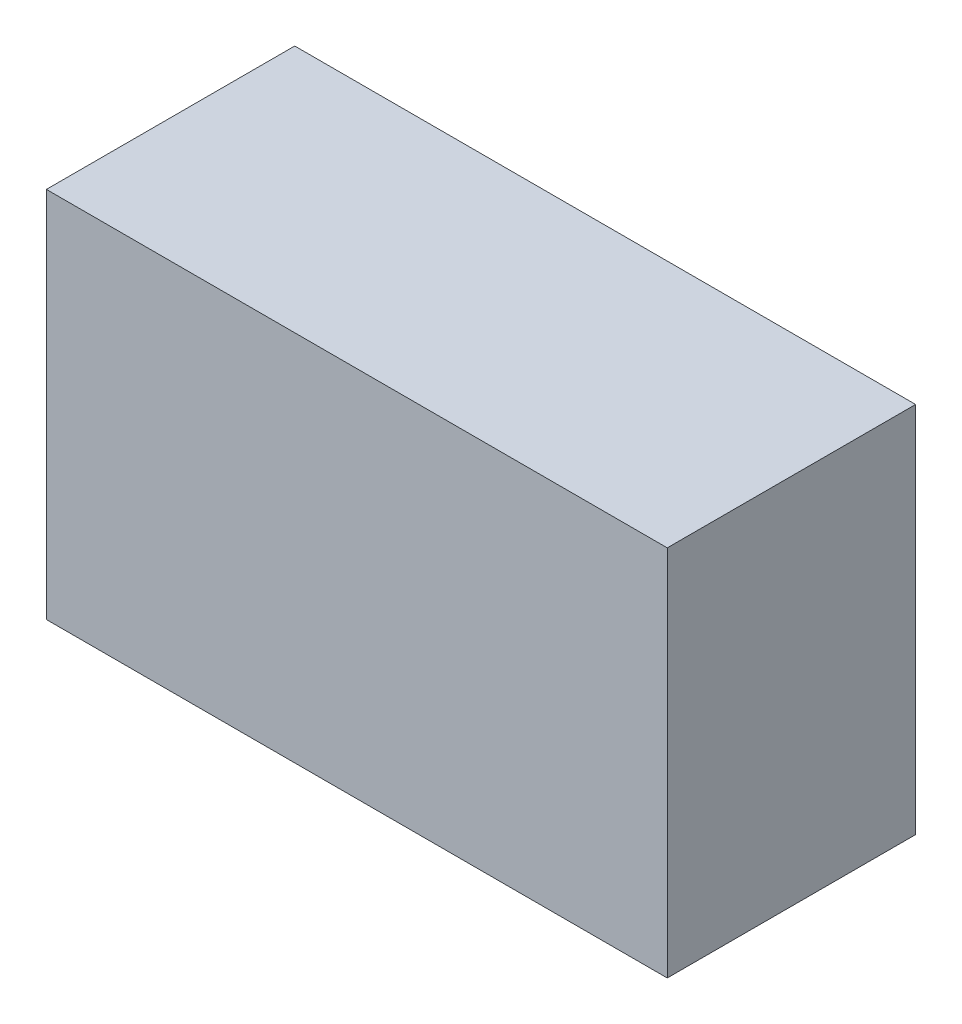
SolidWorks part; units mm, degrees
ref_plane "Front Plane" through (0, 0, 0) normal (1, 0, 0) x (0, 1, 0)
ref_plane "Top Plane" through (0, 0, 0) normal (0, 0, 1) x (0, 1, 0)
ref_plane "Right Plane" through (0, 0, 0) normal (0, 1, 0) x (-1, 0, 0)
sketch "Sketch1" plane through (0, 0, 0) normal (1, 0, 0) x (0, 1, 0)
  line L0 (-19.05, 0) -> (19.05, 0)
  line L1 (19.05, 0) -> (19.05, 25.4)
  line L2 (19.05, 25.4) -> (-19.05, 25.4)
  line L3 (-19.05, 25.4) -> (-19.05, 0)
extrude "Panel_or_block" add sketch "Sketch1" along normal blind 63.5
